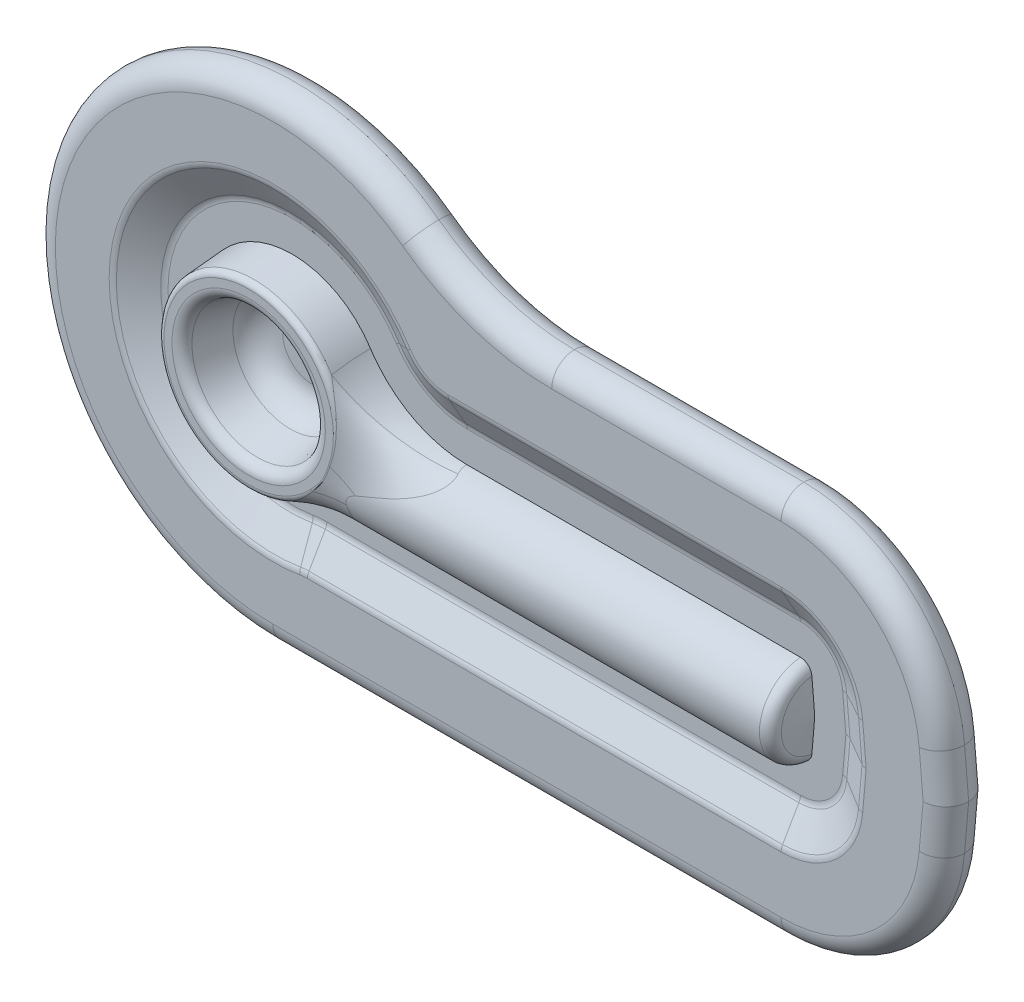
SolidWorks part; units mm, degrees
ref_plane "Plan1" through (0, 0, 0) normal (0, 0, 1) x (1, 0, 0)
ref_plane "Plan2" through (0, 0, 0) normal (0, 1, 0) x (1, 0, 0)
ref_plane "Plan3" through (0, 0, 0) normal (1, 0, 0) x (0, 0, -1)
sketch "Esquisse1" plane through (0, 0, 0) normal (0, 0, 1) x (1, 0, 0)
  circle A0 centre (0, 0) radius 16.2
  dimension "D1" = 32.4
extrude "Base-Extrusion" add sketch "Esquisse1" along normal mid plane 16.3 draft 4
sketch "Esquisse2" plane through (0, 0, 0) normal (0, 0, 1) x (1, 0, 0)
  line L0 (-20, 0) -> (20, 0) construction
  line L1 (-20, -8) -> (94.3291, -8) construction
  line L2 (0, -15.7) -> (88.1673, -15.7)
  line L3 (90.1597, -13.8743) -> (90.6737, -8)
  line L4 (0, -15.7) -> (0, -8)
  line L5 (0, -8) -> (90.6737, -8)
  circle A0 centre (0, 0) radius 15.6301 construction
  arc A1 (90.1597, -13.8743) -> (88.1673, -15.7) centre (88.1673, -13.7) cw
  point P13 (90, -15.7)
  dimension "D5" = 2
  dimension "D1" = 8
  dimension "D2" = 7.7
  dimension "D3" = 95
  dimension "D4" = 90
revolve "Boss.-Révol.1" add sketch "Esquisse2" angle 360 about L1
fillet "Congé4" radius 1
fillet "Congé5" radius 20
sketch "Esquisse3" plane through (0, 0, 0) normal (0, 1, 0) x (1, 0, 0)
  line L0 (0, 20.6238) -> (0, -15.1969) construction
  line L1 (0, 0) -> (0, -7.2198) construction
  line L2 (11.7426, -8.15) -> (0, -8.15)
  line L3 (0, 2.85) -> (0, -8.15)
  line L4 (-14.6976, -8.15) -> (14.6976, -8.15) construction
  line L5 (9, 2.85) -> (11.7426, -8.15)
  line L7 (-32.9547, 0) -> (48.0586, 0) construction
  line L8 (-20, 0) -> (94.3291, 0) construction
  line L9 (0, 2.85) -> (9, 2.85)
  dimension "D2" = 9
  dimension "D1" = 14
  dimension "D4" = 11
revolve "Enlèvement de matière-Révolution1" cut sketch "Esquisse3" angle 360 about L0
fillet "Congé13" radius 5
fillet "Congé15" radius 2
sketch "Esquisse5" plane through (0, 0, 0) normal (0, 1, 0) x (1, 0, 0)
  line L0 (0, 16.1009) -> (0, -12.7842) construction
  line L1 (0, 0) -> (0, -7.2198) construction
  line L2 (0, 5.15) -> (10.8, 5.15)
  line L4 (0, 8.15) -> (0, 5.15)
  line L5 (10.8, 5.15) -> (11.548, 8.15)
  line L6 (11.548, 8.15) -> (0, 8.15)
  line L7 (14.6976, 8.15) -> (-14.6976, 8.15) construction
  dimension "D3" = 14
  dimension "D2" = 10.8
  dimension "D1" = 3
revolve "Enlèvement de matière-Révolution2" cut sketch "Esquisse5" angle 360 about L0
fillet "Congé16" radius 2
fillet "Congé17" radius 2
scale "Echelle1"
sketch "Esquisse7" plane through (0, 0, 0) normal (0, 0, 1) x (1, 0, 0)
  line L0 (97.4644, -1.6368) -> (98.0316, -8.12)
  line L1 (97.4644, -14.6032) -> (98.0316, -8.12)
  line L24 (6.0879, -21.9105) -> (89.4898, -21.9105)
  line L25 (89.4898, 5.6705) -> (30.8393, 5.6705)
  arc A0 (3.7119, -22.1086) -> (6.0879, -21.9105) centre (6.0879, -36.2605) cw
  arc A1 (18.8032, 12.2068) -> (30.8393, 5.6705) centre (30.8393, 20.0205) ccw
  circle A2 centre (0, 0) radius 14
  arc A15 (89.4898, -21.9105) -> (97.4644, -14.6032) centre (89.4898, -13.9055) ccw
  arc A16 (18.8032, 12.2068) -> (3.7119, -22.1086) centre (0, 0) ccw
  arc A17 (97.4644, -1.6368) -> (89.4898, 5.6705) centre (89.4898, -2.3345) ccw
  dimension "D2" = 14.35
  dimension "D3" = 14.35
  dimension "D1" = 28
  dimension "D4" = 170
extrude "Boss.-Extru.1" add sketch "Esquisse7" along normal mid plane 1.2
sketch "Esquisse8" plane through (0, 0, 0) normal (0, 0, 1) x (1, 0, 0)
  line L0 (0, 0) -> (0, -82.1677) construction
  line L1 (0, -42.3205) -> (89.4898, -42.3205)
  line L16 (117.7967, -16.382) -> (118.5196, -8.12)
  line L17 (118.5196, -8.12) -> (117.7967, 0.142)
  line L18 (89.4898, 26.0805) -> (49.0921, 26.0805)
  line L20 (97.4644, -14.6032) -> (98.0316, -8.12)
  line L21 (98.0316, -8.12) -> (97.4644, -1.6368)
  line L22 (89.4898, 5.6705) -> (30.8393, 5.6705)
  line L23 (6.0879, -21.9105) -> (89.4898, -21.9105)
  line L24 (97.4644, -14.6032) -> (98.0316, -8.12)
  line L25 (98.0316, -8.12) -> (97.4644, -1.6368)
  line L26 (89.4898, 5.6705) -> (30.8393, 5.6705)
  line L27 (6.0879, -21.9105) -> (89.4898, -21.9105)
  arc A0 (25.238, 33.9716) -> (0, -42.3205) centre (0, 0) ccw
  arc A1 (49.0921, 26.0805) -> (25.238, 33.9716) centre (49.0921, 66.0805) cw
  arc A18 (89.4898, -42.3205) -> (117.7967, -16.382) centre (89.4898, -13.9055) ccw
  arc A19 (117.7967, 0.142) -> (89.4898, 26.0805) centre (89.4898, -2.3345) ccw
  arc A21 (89.4898, -21.9105) -> (97.4644, -14.6032) centre (89.4898, -13.9055) ccw
  arc A22 (97.4644, -1.6368) -> (89.4898, 5.6705) centre (89.4898, -2.3345) ccw
  arc A23 (18.8032, 12.2068) -> (30.8393, 5.6705) centre (30.8393, 20.0205) ccw
  arc A24 (18.8032, 12.2068) -> (3.7119, -22.1086) centre (0, 0) ccw
  arc A25 (6.0879, -21.9105) -> (3.7119, -22.1086) centre (6.0879, -36.2605) ccw
  arc A26 (89.4898, -21.9105) -> (97.4644, -14.6032) centre (89.4898, -13.9055) ccw
  arc A27 (97.4644, -1.6368) -> (89.4898, 5.6705) centre (89.4898, -2.3345) ccw
  arc A28 (18.8032, 12.2068) -> (30.8393, 5.6705) centre (30.8393, 20.0205) ccw
  arc A29 (18.8032, 12.2068) -> (3.7119, -22.1086) centre (0, 0) ccw
  arc A30 (6.0879, -21.9105) -> (3.7119, -22.1086) centre (6.0879, -36.2605) ccw
  dimension "D2" = 0
  dimension "D1" = 28.415
  dimension "D3" = 28.415
  dimension "D4" = 40
extrude "Boss.-Extru.2" add sketch "Esquisse8" along normal mid plane 8
fillet "Congé9" radius 4
fillet "Congé10" radius 4
draft "Dépouille1" type of draft neutral plane draft angle 60 faces to draft 9 parameters "D1"=60
draft "Dépouille3" type of draft neutral plane draft angle 60 faces to draft 9 parameters "D1"=60
fillet "Congé11" radius 2
fillet "Congé12" radius 2
